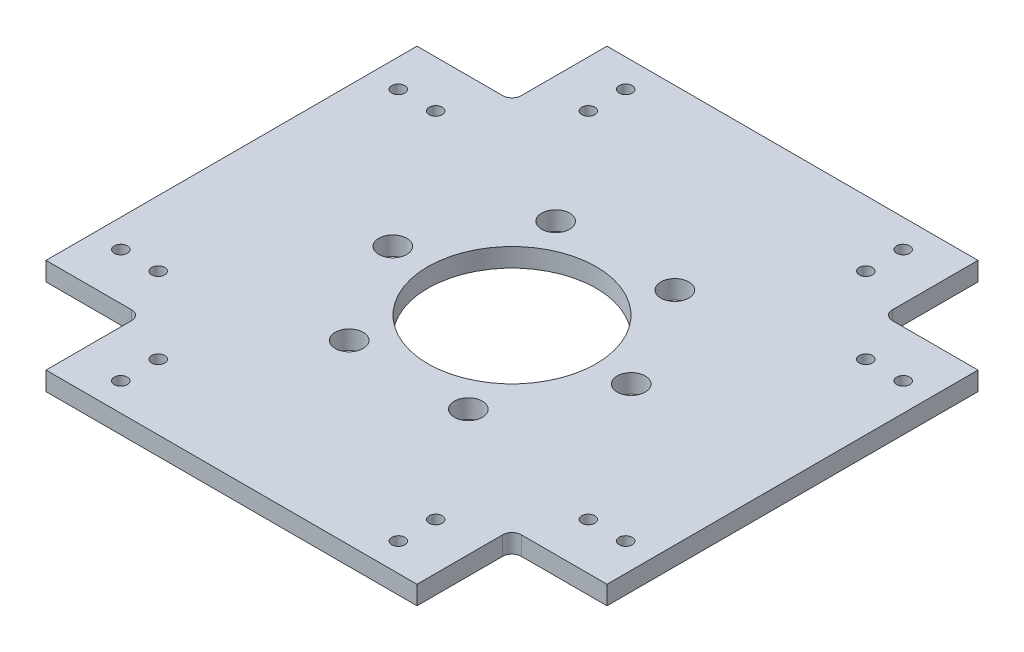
SolidWorks part; units mm, degrees
ref_plane "Front Plane" through (0, 0, 0) normal (0, 0, 1) x (1, 0, 0)
ref_plane "Top Plane" through (0, 0, 0) normal (0, 1, 0) x (1, 0, 0)
ref_plane "Right Plane" through (0, 0, 0) normal (1, 0, 0) x (0, 0, -1)
sketch "Sketch1" plane through (0, 0, 0) normal (0, 1, 0) x (1, 0, 0)
  line L0 (-99.2, 150) -> (-99.2, 99.2)
  line L1 (-99.2, -150) -> (99.2, -150)
  line L2 (-150, -99.2) -> (-150, 99.2)
  line L3 (-99.2, 150) -> (99.2, 150)
  line L4 (150, -99.2) -> (150, 99.2)
  line L5 (-124.6, -124.6) -> (99.2, 99.2) construction
  line L6 (-99.2, 99.2) -> (99.2, -99.2) construction
  line L7 (-150, -150) -> (-99.2, -150) construction
  line L8 (-150, -150) -> (-150, -99.2) construction
  line L9 (-150, -99.2) -> (-99.2, -99.2)
  line L10 (-99.2, -150) -> (-99.2, -99.2)
  line L11 (-124.6, -124.6) -> (-99.2, -99.2) construction
  line L12 (-150, -99.2) -> (-99.2, -150) construction
  line L13 (-150, 99.2) -> (-99.2, 99.2)
  line L14 (150, 99.2) -> (99.2, 99.2)
  line L15 (99.2, 150) -> (99.2, 99.2)
  line L16 (99.2, -150) -> (99.2, -99.2)
  line L17 (150, -99.2) -> (99.2, -99.2)
  line L18 (-150, -150) -> (-99.2, -150) construction
  line L19 (-150, -150) -> (-124.6, -124.6) construction
  line L20 (-150, -150) -> (-124.6, -124.6) construction
  line L21 (-150, -150) -> (-150, -99.2) construction
  line L22 (99.2, -150) -> (150, -150) construction
  line L23 (99.2, -99.2) -> (150, -150) construction
  line L24 (150, -150) -> (150, -99.2) construction
  line L25 (150, 99.2) -> (150, 150) construction
  line L26 (99.2, 99.2) -> (150, 150) construction
  line L27 (99.2, 150) -> (150, 150) construction
  line L28 (-150, 150) -> (-99.2, 150) construction
  line L29 (-150, 150) -> (-99.2, 99.2) construction
  line L30 (-150, 99.2) -> (-150, 150) construction
  line L31 (150, -99.2) -> (150, 99.2) construction
  circle A0 centre (0, 0) radius 45
  point P10 (-124.6, -124.6)
  point P23 (0, 0)
  dimension "D1" = 90
  dimension "D2" = 4
  dimension "2 in sqaure tubeing" = 50.8
extrude "Boss-Extrude1" add sketch "Sketch1" along normal blind 10
fillet "Fillet1" radius 5 4 edges at (-99.2, 5, 99.2) (99.2, 5, 99.2) (99.2, 5, -99.2) (-99.2, 5, -99.2)
sketch "Sketch2" plane through (0, 0, 0) normal (0, -1, 0) x (1, 0, 0)
  circle A0 centre (40.1279, -80) radius 6.35 construction
  circle A1 centre (-40.1279, -80) radius 6.35 construction
  circle A2 centre (40.1279, 80) radius 6.35 construction
  circle A3 centre (-40.1279, 80) radius 6.35 construction
  circle A4 centre (40.1279, -80) radius 6.35
  circle A5 centre (-40.1279, -80) radius 6.35
  circle A6 centre (40.1279, 80) radius 6.35
  circle A7 centre (-40.1279, 80) radius 6.35
extrude "Cut-Extrude1" cut sketch "Sketch2" against normal blind 5
chamfer "Chamfer1" distance 1 angle 45 4 edges at (-40.1279, 0, 73.65) (40.1279, 0, 73.65) (-40.1279, 0, -86.35) (40.1279, 0, -86.35)
sketch "Sketch3" plane through (0, 10, 0) normal (0, 1, 0) x (1, 0, 0)
  line L0 (0, 0) -> (147.2102, -147.2102)
  circle A0 centre (135, -74.2) radius 3.5 construction
  circle A1 centre (115, -74.2) radius 3.5 construction
  circle A2 centre (135, -74.2) radius 3.5
  circle A3 centre (115, -74.2) radius 3.5
  arc A4 (140.475, -150) -> (150, -140.475) centre (140.475, -140.475) ccw construction
  circle A5 centre (74.2, -135) radius 3.5
  circle A6 centre (74.2, -115) radius 3.5
  circle A7 centre (-74.2, -115) radius 3.5
  circle A8 centre (-74.2, -135) radius 3.5
  circle A9 centre (-135, -74.2) radius 3.5
  circle A10 centre (-115, -74.2) radius 3.5
  circle A11 centre (-115, 74.2) radius 3.5
  circle A12 centre (-135, 74.2) radius 3.5
  circle A13 centre (-74.2, 135) radius 3.5
  circle A14 centre (-74.2, 115) radius 3.5
  circle A15 centre (74.2, 115) radius 3.5
  circle A16 centre (74.2, 135) radius 3.5
  circle A17 centre (135, 74.2) radius 3.5
  circle A18 centre (115, 74.2) radius 3.5
  point P43 (0, 0)
  dimension "D1" = 4
extrude "Cut-Extrude2" cut sketch "Sketch3" against normal through all contours A12 | A11 | A13 | A14 | A15 | A16 | A18 | A17 | A8 | A7 | A9 | A10 | A6 | A5 | A3 | A2
sketch "Sketch4" plane through (0, 0, 0) normal (0, -1, 0) x (1, 0, 0)
  line L12 (-99.2, 150) -> (-99.2, 104.2)
  line L13 (-104.2, 99.2) -> (-150, 99.2)
  line L14 (-150, 99.2) -> (-150, -99.2)
  line L15 (-150, -99.2) -> (-104.2, -99.2)
  line L16 (-99.2, -104.2) -> (-99.2, -150)
  line L17 (-99.2, -150) -> (99.2, -150)
  line L18 (99.2, -150) -> (99.2, -104.2)
  line L19 (104.2, -99.2) -> (150, -99.2)
  line L20 (150, -99.2) -> (150, 99.2)
  line L21 (150, 99.2) -> (104.2, 99.2)
  line L22 (99.2, 104.2) -> (99.2, 150)
  line L23 (99.2, 150) -> (-99.2, 150)
  line L24 (-99.2, 150) -> (-99.2, 104.2)
  line L25 (-104.2, 99.2) -> (-150, 99.2)
  line L26 (-150, 99.2) -> (-150, -99.2)
  line L27 (-150, -99.2) -> (-104.2, -99.2)
  line L28 (-99.2, -104.2) -> (-99.2, -150)
  line L29 (-99.2, -150) -> (99.2, -150)
  line L30 (99.2, -150) -> (99.2, -104.2)
  line L31 (104.2, -99.2) -> (150, -99.2)
  line L32 (150, -99.2) -> (150, 99.2)
  line L33 (150, 99.2) -> (104.2, 99.2)
  line L34 (99.2, 104.2) -> (99.2, 150)
  line L35 (99.2, 150) -> (-99.2, 150)
  circle A0 centre (-63.75, 0) radius 7.5 construction
  circle A1 centre (-63.75, 0) radius 7.5
  circle A2 centre (-31.875, -55.2091) radius 7.5 construction
  circle A3 centre (31.875, -55.2091) radius 7.5 construction
  arc A4 (-104.2, 99.2) -> (-99.2, 104.2) centre (-104.2, 104.2) ccw
  arc A5 (-99.2, -104.2) -> (-104.2, -99.2) centre (-104.2, -104.2) ccw
  arc A6 (104.2, -99.2) -> (99.2, -104.2) centre (104.2, -104.2) ccw
  arc A7 (99.2, 104.2) -> (104.2, 99.2) centre (104.2, 104.2) ccw
  arc A8 (-104.2, 99.2) -> (-99.2, 104.2) centre (-104.2, 104.2) ccw
  arc A9 (-99.2, -104.2) -> (-104.2, -99.2) centre (-104.2, -104.2) ccw
  arc A10 (104.2, -99.2) -> (99.2, -104.2) centre (104.2, -104.2) ccw
  arc A11 (99.2, 104.2) -> (104.2, 99.2) centre (104.2, 104.2) ccw
  circle A12 centre (63.75, 0) radius 7.5 construction
  circle A13 centre (31.875, 55.2091) radius 7.5 construction
  circle A14 centre (-31.875, 55.2091) radius 7.5 construction
  circle A15 centre (-31.875, -55.2091) radius 7.5
  circle A16 centre (31.875, -55.2091) radius 7.5
  circle A17 centre (63.75, 0) radius 7.5
  circle A18 centre (31.875, 55.2091) radius 7.5
  circle A19 centre (-31.875, 55.2091) radius 7.5
  dimension "D1" = 0
extrude "Cut-Extrude3" cut sketch "Sketch4" against normal through all contours A15 | A16 | A17 | A18 | A19 | A1
